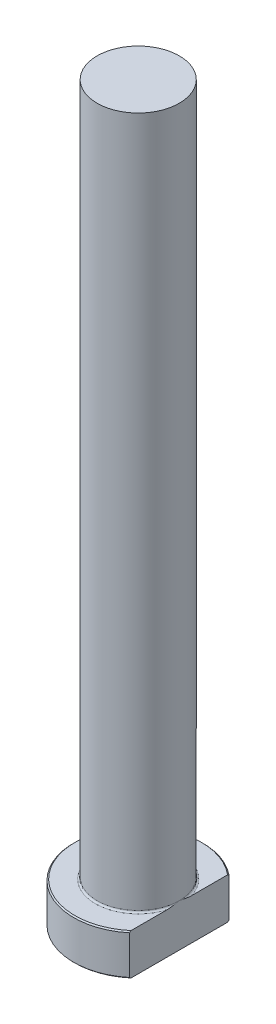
SolidWorks part; units mm, degrees
ref_plane "Front Plane" through (0, 0, 0) normal (0, 0, 1) x (1, 0, 0)
ref_plane "Top Plane" through (0, 0, 0) normal (0, 1, 0) x (1, 0, 0)
ref_plane "Right Plane" through (0, 0, 0) normal (1, 0, 0) x (0, 0, -1)
sketch "Sketch1" plane through (0, 0, 0) normal (0, 0, 1) x (1, 0, 0)
  line L0 (0, 259.9588) -> (0, -15.1925) construction
  line L1 (0, 0) -> (-11, 0)
  line L2 (-11, 0) -> (-11, 7)
  line L3 (-11, 7) -> (-7, 7)
  line L4 (-7, 7) -> (-7, 125)
  line L5 (-7, 125) -> (0, 125)
  line L6 (0, 125) -> (0, 0)
  dimension "L" = 125
  dimension "H" = 22
  dimension "T" = 7
  dimension "D" = 14
revolve "Revolve1" add sketch "Sketch1" angle 360 about L0
chamfer "Chamfer1" distance 0.2 angle 45 2 edges at (0, 7, 11) (0, 0, 11)
fillet "Fillet1" radius 0.3 1 edges at (0, 7, 7)
sketch "Sketch2" plane through (0, 0, 0) normal (0, 1, 0) x (1, 0, 0)
  line L0 (7, 8.4853) -> (7, -8.4853)
  circle A0 centre (0, 0) radius 11 construction
  arc A1 (7, -8.4853) -> (7, 8.4853) centre (0, 0) ccw
  circle A2 centre (0, 0) radius 7 construction
extrude "KEY" cut sketch "Sketch2" along normal through all
